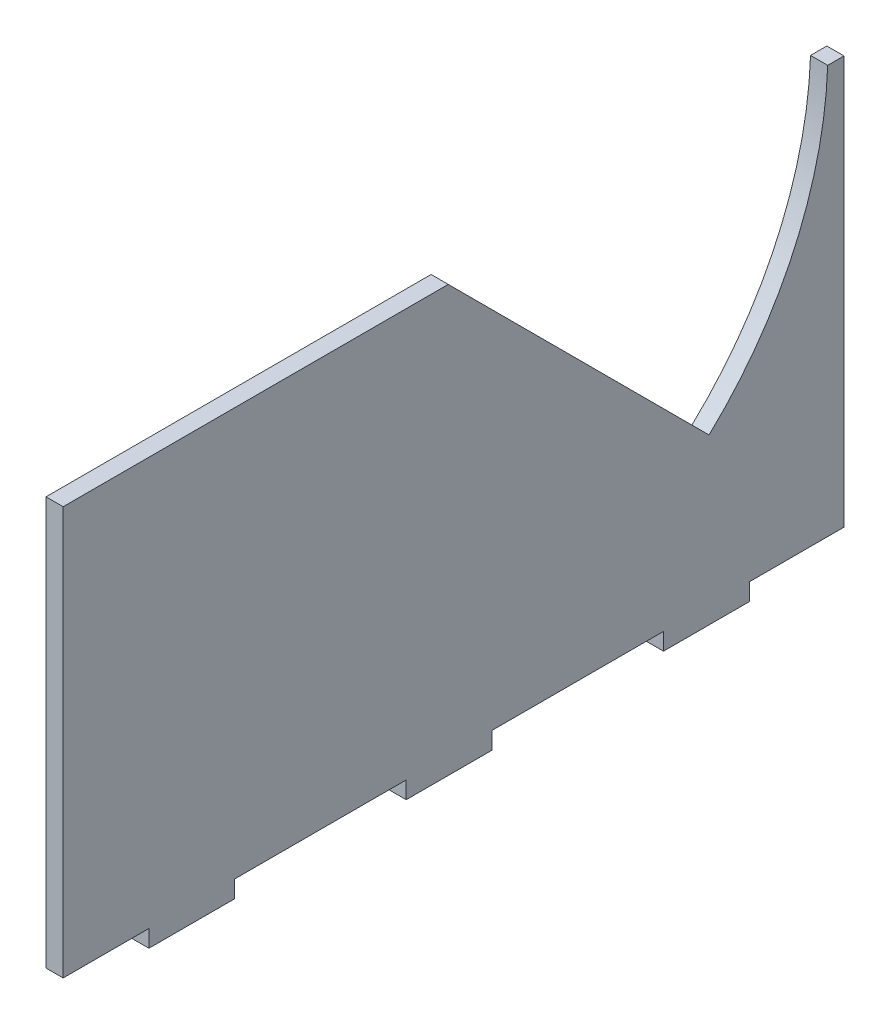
SolidWorks part; units mm, degrees
ref_plane "Front Plane" through (0, 0, 0) normal (0, 0, 1) x (1, 0, 0)
ref_plane "Top Plane" through (0, 0, 0) normal (0, 1, 0) x (1, 0, 0)
ref_plane "Right Plane" through (0, 0, 0) normal (1, 0, 0) x (0, 0, -1)
sketch "Sketch1" plane through (0, 0, 0) normal (1, 0, 0) x (0, 0, -1)
  line L0 (0, 0) -> (100, 0)
  line L1 (449.0195, 475.9175) -> (0, 475.9175)
  line L2 (891.4654, 475.9175) -> (910.4654, 475.9175)
  line L3 (100, 0) -> (100, -20)
  line L4 (910.4654, 475.9175) -> (910.4654, 0)
  line L5 (100, -20) -> (200, -20)
  line L6 (0, 475.9175) -> (0, 0)
  line L7 (753.0892, 171.8478) -> (449.0195, 475.9175)
  line L8 (200, -20) -> (200, 0)
  line L9 (200, 0) -> (400, 0)
  line L10 (400, 0) -> (400, -20)
  line L11 (400, -20) -> (500, -20)
  line L12 (500, -20) -> (500, 0)
  line L13 (500, 0) -> (700, 0)
  line L14 (700, 0) -> (700, -20)
  line L15 (700, -20) -> (800, -20)
  line L16 (800, -20) -> (800, 0)
  line L17 (800, 0) -> (910.4654, 0)
  arc A0 (753.0892, 171.8478) -> (891.4654, 475.9175) centre (455.2327, 490.9175) ccw
  dimension "D1" = 436.4905
  dimension "D2" = 100
  dimension "D3" = 400
  dimension "D4" = 449.0195
  dimension "D5" = 455.2327
  dimension "D6" = 753.0892
  dimension "D7" = 891.4654
  dimension "D8" = 910.4654
  dimension "D9" = 171.8478
  dimension "D12" = 20
extrude "Boss-Extrude1" add sketch "Sketch1" along normal blind 20
